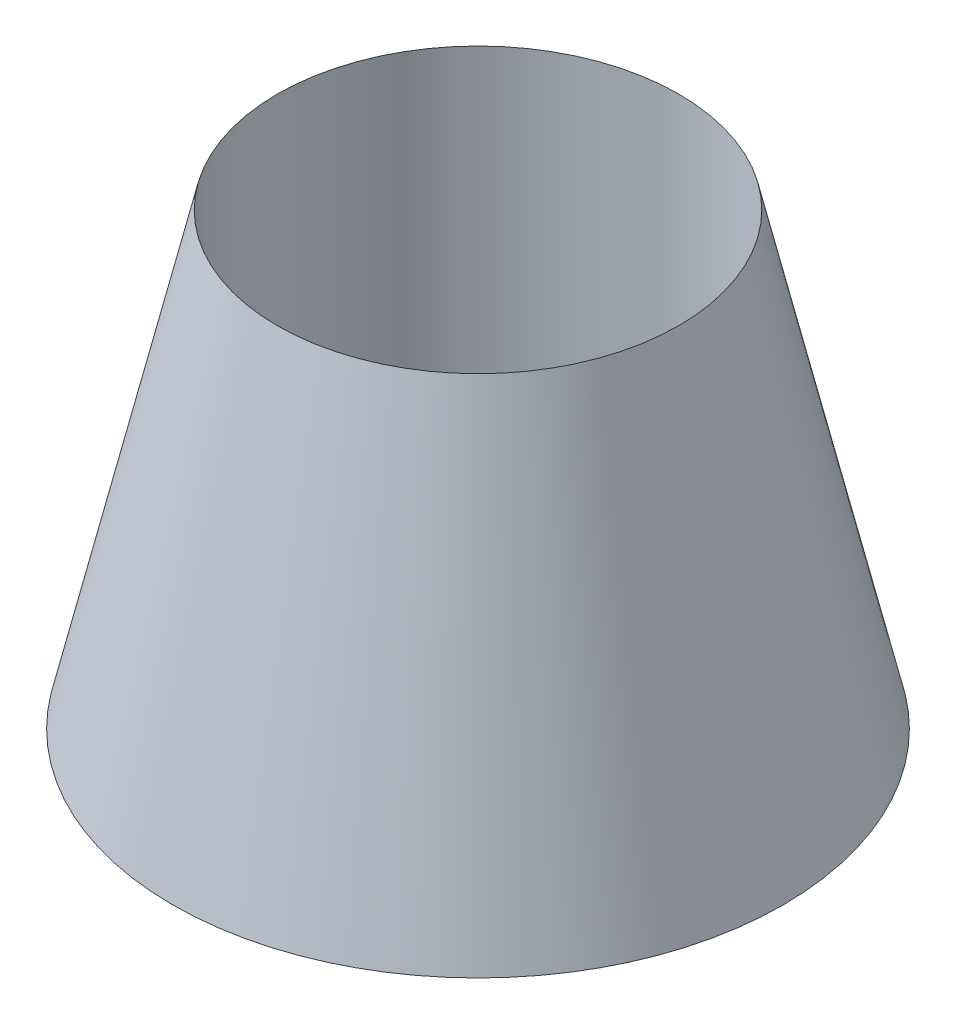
SolidWorks part; units mm, degrees
ref_plane "Front Plane" through (0, 0, 0) normal (0, 0, 1) x (1, 0, 0)
ref_plane "Top Plane" through (0, 0, 0) normal (0, 1, 0) x (1, 0, 0)
ref_plane "Right Plane" through (0, 0, 0) normal (1, 0, 0) x (0, 0, -1)
sketch "Sketch1" plane through (0, 0, 0) normal (1, 0, 0) x (0, 0, -1)
  line L0 (1.5875, 3.556) -> (1.5875, 0)
  line L1 (1.5875, 0) -> (2.413, 0)
  line L2 (1.5875, 3.556) -> (2.413, 0)
  line L3 (0, 0) -> (0, 4.0282) construction
  dimension "D1" = 1.5875
  dimension "D2" = 3.556
  dimension "D3" = 2.413
revolve "Revolve1" add sketch "Sketch1" angle 360 about L3
